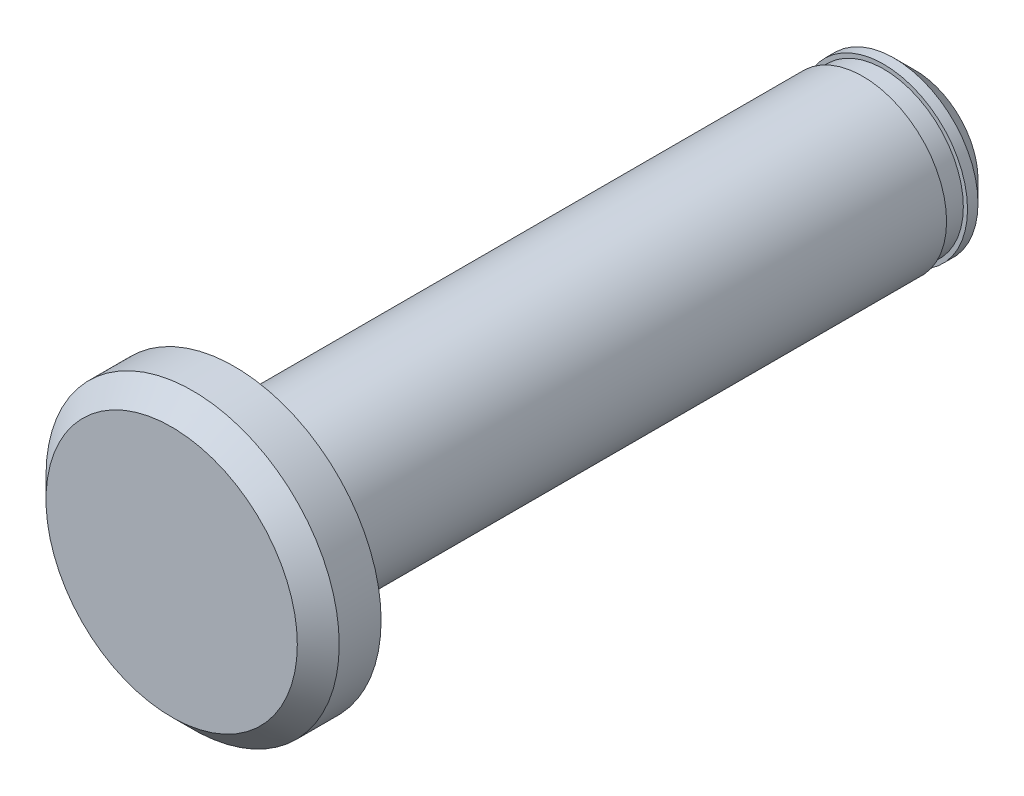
SolidWorks part; units mm, degrees
ref_plane "Plane1" through (0, 0, 0) normal (0, 0, 1) x (1, 0, 0)
ref_plane "Plane2" through (0, 0, 0) normal (0, 1, 0) x (1, 0, 0)
ref_plane "Plane3" through (0, 0, 0) normal (1, 0, 0) x (0, 0, -1)
sketch "Esquisse2" plane through (0, 0, 0) normal (0, 1, 0) x (1, 0, 0)
  line L0 (-16.6808, -30.6262) -> (-16.6808, -10.5992)
  line L1 (-16.6808, -10.5992) -> (-16.4808, -10.5992)
  line L2 (-16.4808, -10.5992) -> (-16.4808, -9.5992)
  line L3 (-16.4808, -9.5992) -> (-16.6808, -9.5992)
  line L4 (-16.6808, -9.5992) -> (-16.6808, -9.0992)
  line L5 (-16.6808, -9.0992) -> (-15.6808, -8.0992)
  line L6 (-15.6808, -8.0992) -> (-12.6808, -8.0992)
  line L7 (-16.6808, -40.5992) -> (-19.6808, -40.5992)
  line L8 (-19.6808, -40.5992) -> (-19.6808, -42.5992)
  line L9 (-19.6808, -42.5992) -> (-18.6808, -43.5992)
  line L10 (-18.6808, -43.5992) -> (-12.6808, -43.5992)
  line L11 (-12.6808, -43.5992) -> (-12.6808, -8.0992)
  line L12 (-12.6808, -67.5379) -> (-12.6808, 36.378) construction
  line L13 (-16.6808, -30.6262) -> (-16.6808, -40.5992)
  dimension "D1" = 3.8
  dimension "D2" = 4
  dimension "D3" = 4
  dimension "D4" = 7
  dimension "D5" = 3
  dimension "D6" = 225
  dimension "D7" = 1
  dimension "D8" = 32.5
  dimension "D9" = 1
  dimension "D10" = 45
  dimension "D11" = 30
  dimension "D12" = 1
revolve "Base-Révolution" add sketch "Esquisse2" angle 360 about L12
